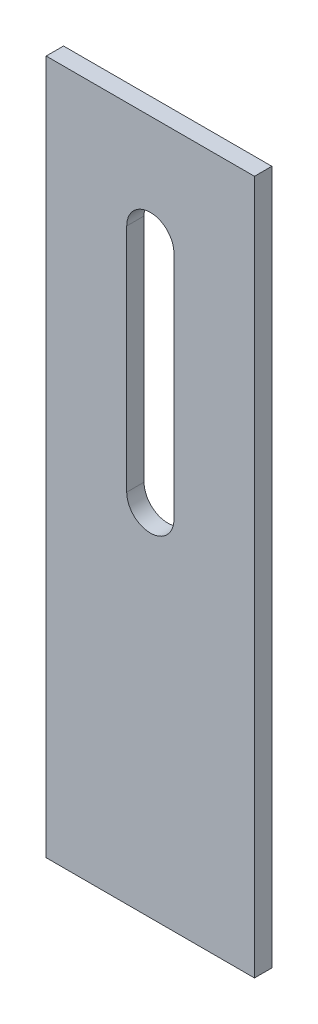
SolidWorks part; units mm, degrees
ref_plane "Plan de face" through (0, 0, 0) normal (0, 0, 1) x (1, 0, 0)
ref_plane "Plan de dessus" through (0, 0, 0) normal (0, 1, 0) x (1, 0, 0)
ref_plane "Plan de droite" through (0, 0, 0) normal (1, 0, 0) x (0, 0, -1)
sketch "Esquisse1" plane through (0, 0, 0) normal (0, 0, 1) x (1, 0, 0)
  line L0 (0, 84.6) -> (0, 51.4) construction
  line L1 (-15, 100) -> (15, 100)
  line L2 (-15, 100) -> (-15, 0)
  line L3 (-15, 0) -> (15, 0)
  line L4 (15, 100) -> (15, 0)
  line L5 (-3.4, 84.6) -> (-3.4, 51.4)
  line L6 (3.4, 84.6) -> (3.4, 51.4)
  arc A0 (-3.4, 84.6) -> (3.4, 84.6) centre (0, 84.6) cw
  arc A1 (-3.4, 51.4) -> (3.4, 51.4) centre (0, 51.4) ccw
  dimension "D5" = 40
  dimension "D6" = 12
  dimension "D1" = 30
  dimension "D2" = 100
  dimension "D3" = 3.4
  dimension "D4" = 3.4
sheet metal parameters "Tôlerie 1" thickness 2.5 parameters "D1"=10
base flange "Tôle de base pliée1" sketch "Esquisse1" thickness 2.5 reverse thickness direction yes parameters "D1"=10
flat pattern "Etat déplié1"
sketch "Lignes de pliage1" plane through (0, 0, 0) normal (0, 1, 0) x (-1, 0, 0)
